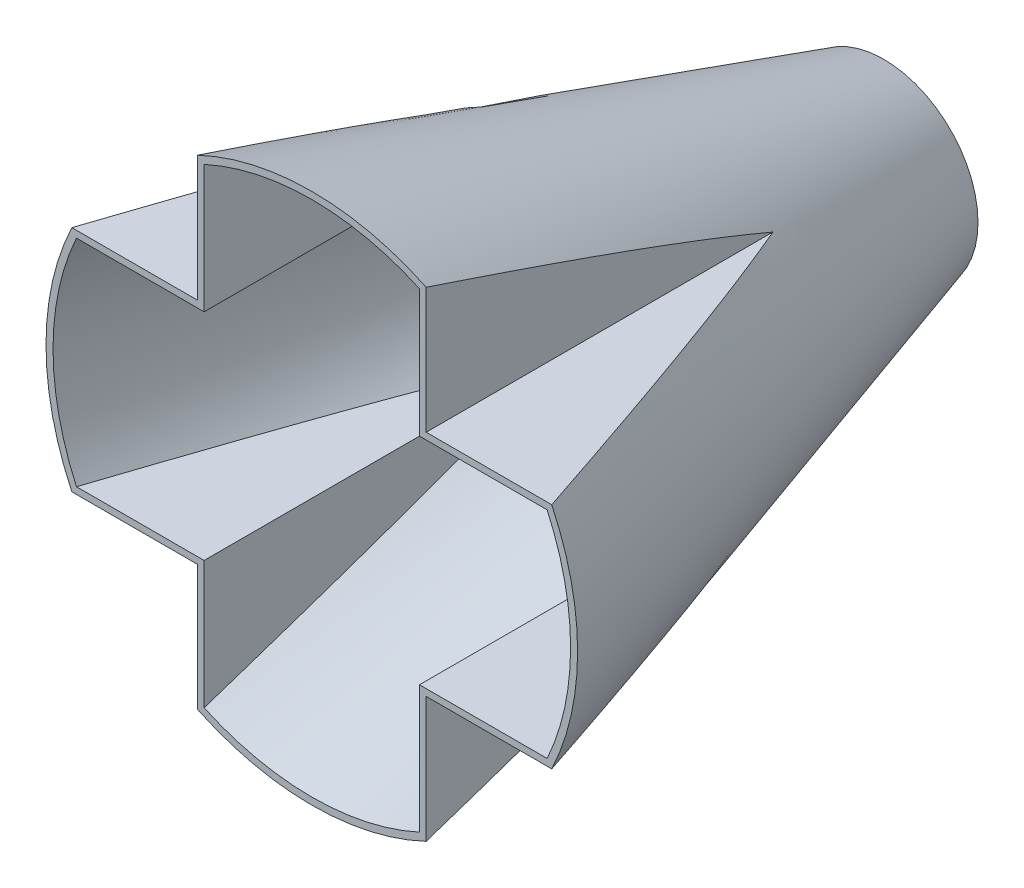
SolidWorks part; units mm, degrees
ref_plane "Alzado" through (0, 0, 0) normal (0, 0, 1) x (1, 0, 0)
ref_plane "Planta" through (0, 0, 0) normal (0, 1, 0) x (1, 0, 0)
ref_plane "Vista lateral" through (0, 0, 0) normal (1, 0, 0) x (0, 0, -1)
sketch "Croquis1" plane through (0, 0, 0) normal (0, 1, 0) x (1, 0, 0)
  line L0 (0, 0) -> (39.5, 0)
  line L1 (0, 0) -> (0, 85)
  line L2 (0, 85) -> (14, 85)
  line L3 (14, 85) -> (39.5, 0)
revolve "Revolución1" add sketch "Croquis1" angle 360 about L1
sketch "Croquis2" plane through (0, 0, 0) normal (0, 0, 1) x (1, 0, 0)
  line L0 (0, 59.7491) -> (0, -40) construction
  line L1 (-57.1256, 0) -> (54.018, 0) construction
  line L6 (-17, 35.7211) -> (-17, 17)
  line L7 (-35.7211, -17) -> (-17, -17)
  line L8 (17, 35.7211) -> (17, 17)
  line L9 (-35.7211, 17) -> (-17, 17)
  line L10 (-17, 59.7491) -> (-17, -55.4187) construction
  line L11 (-57.1256, 17) -> (54.018, 17) construction
  line L12 (-17, -17) -> (-17, -35.7211)
  line L13 (17, 17) -> (35.7211, 17)
  line L14 (17, -17) -> (17, -35.7211)
  line L15 (17, 59.7491) -> (17, -55.4187) construction
  line L16 (17, -17) -> (35.7211, -17)
  line L17 (-57.1256, -17) -> (54.018, -17) construction
  line L18 (0, 59.7491) -> (0, -55.4187) construction
  arc A8 (-17, 35.7211) -> (-35.7211, 17) centre (0, 0) ccw
  arc A9 (-35.7211, -17) -> (-17, -35.7211) centre (0, 0) ccw
  arc A10 (35.7211, 17) -> (17, 35.7211) centre (0, 0) ccw
  arc A11 (17, -35.7211) -> (35.7211, -17) centre (0, 0) ccw
  dimension "D1" = 17
  dimension "D2" = 17
extrude "Cortar-Extruir2" cut sketch "Croquis2" against normal blind 100
shell "Vaciado1" thickness 1
